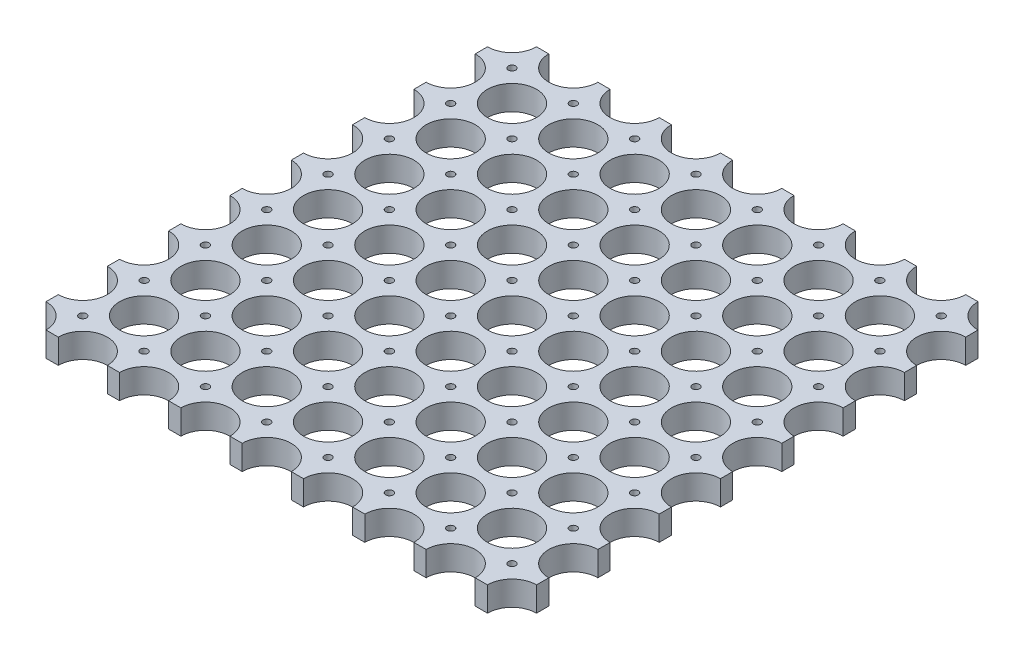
SolidWorks part; units mm, degrees
ref_plane "Front Plane" through (0, 0, 0) normal (0, 0, 1) x (1, 0, 0)
ref_plane "Top Plane" through (0, 0, 0) normal (0, 1, 0) x (1, 0, 0)
ref_plane "Right Plane" through (0, 0, 0) normal (1, 0, 0) x (0, 0, -1)
sketch "Sketch1" plane through (0, 0, 0) normal (0, 1, 0) x (1, 0, 0)
  line L1 (-50, 50) -> (50, 50)
  line L2 (-50, 50) -> (-50, -50)
  line L3 (-50, -50) -> (50, -50)
  line L4 (50, 50) -> (50, -50)
  line L5 (-50, 50) -> (50, -50) construction
  line L6 (-50, -50) -> (50, 50) construction
  point P0 (0, 0)
  dimension "D1" = 100
  dimension "D2" = 100
extrude "Boss-Extrude1" add sketch "Sketch1" along normal blind 5
sketch "Sketch3" plane through (0, 0, 0) normal (0, -1, 0) x (1, 0, 0)
  line L0 (-50, -50) -> (-50, 50) construction
  circle A0 centre (-50, 50) radius 5
  circle A1 centre (-37.5, 50) radius 5
  circle A2 centre (-25, 50) radius 5
  circle A3 centre (-12.5, 50) radius 5
  circle A4 centre (0, 50) radius 5
  circle A5 centre (12.5, 50) radius 5
  circle A6 centre (25, 50) radius 5
  circle A7 centre (37.5, 50) radius 5
  circle A8 centre (50, 50) radius 5
  circle A9 centre (-50, 37.5) radius 5
  circle A10 centre (-37.5, 37.5) radius 5
  circle A11 centre (-25, 37.5) radius 5
  circle A12 centre (-12.5, 37.5) radius 5
  circle A13 centre (0, 37.5) radius 5
  circle A14 centre (12.5, 37.5) radius 5
  circle A15 centre (25, 37.5) radius 5
  circle A16 centre (37.5, 37.5) radius 5
  circle A17 centre (50, 37.5) radius 5
  circle A18 centre (-50, 25) radius 5
  circle A19 centre (-37.5, 25) radius 5
  circle A20 centre (-25, 25) radius 5
  circle A21 centre (-12.5, 25) radius 5
  circle A22 centre (0, 25) radius 5
  circle A23 centre (12.5, 25) radius 5
  circle A24 centre (25, 25) radius 5
  circle A25 centre (37.5, 25) radius 5
  circle A26 centre (50, 25) radius 5
  circle A27 centre (-50, 12.5) radius 5
  circle A28 centre (-37.5, 12.5) radius 5
  circle A29 centre (-25, 12.5) radius 5
  circle A30 centre (-12.5, 12.5) radius 5
  circle A31 centre (0, 12.5) radius 5
  circle A32 centre (12.5, 12.5) radius 5
  circle A33 centre (25, 12.5) radius 5
  circle A34 centre (37.5, 12.5) radius 5
  circle A35 centre (50, 12.5) radius 5
  circle A36 centre (-50, 0) radius 5
  circle A37 centre (-37.5, 0) radius 5
  circle A38 centre (-25, 0) radius 5
  circle A39 centre (-12.5, 0) radius 5
  circle A40 centre (0, 0) radius 5
  circle A41 centre (12.5, 0) radius 5
  circle A42 centre (25, 0) radius 5
  circle A43 centre (37.5, 0) radius 5
  circle A44 centre (50, 0) radius 5
  circle A45 centre (-50, -12.5) radius 5
  circle A46 centre (-37.5, -12.5) radius 5
  circle A47 centre (-25, -12.5) radius 5
  circle A48 centre (-12.5, -12.5) radius 5
  circle A49 centre (0, -12.5) radius 5
  circle A50 centre (12.5, -12.5) radius 5
  circle A51 centre (25, -12.5) radius 5
  circle A52 centre (37.5, -12.5) radius 5
  circle A53 centre (50, -12.5) radius 5
  circle A54 centre (-50, -25) radius 5
  circle A55 centre (-37.5, -25) radius 5
  circle A56 centre (-25, -25) radius 5
  circle A57 centre (-12.5, -25) radius 5
  circle A58 centre (0, -25) radius 5
  circle A59 centre (12.5, -25) radius 5
  circle A60 centre (25, -25) radius 5
  circle A61 centre (37.5, -25) radius 5
  circle A62 centre (50, -25) radius 5
  circle A63 centre (-50, -37.5) radius 5
  circle A64 centre (-37.5, -37.5) radius 5
  circle A65 centre (-25, -37.5) radius 5
  circle A66 centre (-12.5, -37.5) radius 5
  circle A67 centre (0, -37.5) radius 5
  circle A68 centre (12.5, -37.5) radius 5
  circle A69 centre (25, -37.5) radius 5
  circle A70 centre (37.5, -37.5) radius 5
  circle A71 centre (50, -37.5) radius 5
  circle A72 centre (-50, -50) radius 5
  circle A73 centre (-37.5, -50) radius 5
  circle A74 centre (-25, -50) radius 5
  circle A75 centre (-12.5, -50) radius 5
  circle A76 centre (0, -50) radius 5
  circle A77 centre (12.5, -50) radius 5
  circle A78 centre (25, -50) radius 5
  circle A79 centre (37.5, -50) radius 5
  circle A80 centre (50, -50) radius 5
  dimension "D1" = 10
extrude "Cut-Extrude1" cut sketch "Sketch3" against normal blind 5
sketch "Sketch4" plane through (0, 0, 0) normal (0, 1, 0) x (1, 0, 0)
  line L0 (-50, -42.5) -> (-50, -45) construction
  line L1 (-45, -50) -> (-42.5, -50) construction
  circle A0 centre (-43.75, -43.75) radius 0.75
  circle A1 centre (-31.25, -43.75) radius 0.75
  circle A2 centre (-18.75, -43.75) radius 0.75
  circle A3 centre (-6.25, -43.75) radius 0.75
  circle A4 centre (6.25, -43.75) radius 0.75
  circle A5 centre (18.75, -43.75) radius 0.75
  circle A6 centre (31.25, -43.75) radius 0.75
  circle A7 centre (43.75, -43.75) radius 0.75
  circle A8 centre (-43.75, -31.25) radius 0.75
  circle A9 centre (-31.25, -31.25) radius 0.75
  circle A10 centre (-18.75, -31.25) radius 0.75
  circle A11 centre (-6.25, -31.25) radius 0.75
  circle A12 centre (6.25, -31.25) radius 0.75
  circle A13 centre (18.75, -31.25) radius 0.75
  circle A14 centre (31.25, -31.25) radius 0.75
  circle A15 centre (43.75, -31.25) radius 0.75
  circle A16 centre (-43.75, -18.75) radius 0.75
  circle A17 centre (-31.25, -18.75) radius 0.75
  circle A18 centre (-18.75, -18.75) radius 0.75
  circle A19 centre (-6.25, -18.75) radius 0.75
  circle A20 centre (6.25, -18.75) radius 0.75
  circle A21 centre (18.75, -18.75) radius 0.75
  circle A22 centre (31.25, -18.75) radius 0.75
  circle A23 centre (43.75, -18.75) radius 0.75
  circle A24 centre (-43.75, -6.25) radius 0.75
  circle A25 centre (-31.25, -6.25) radius 0.75
  circle A26 centre (-18.75, -6.25) radius 0.75
  circle A27 centre (-6.25, -6.25) radius 0.75
  circle A28 centre (6.25, -6.25) radius 0.75
  circle A29 centre (18.75, -6.25) radius 0.75
  circle A30 centre (31.25, -6.25) radius 0.75
  circle A31 centre (43.75, -6.25) radius 0.75
  circle A32 centre (-43.75, 6.25) radius 0.75
  circle A33 centre (-31.25, 6.25) radius 0.75
  circle A34 centre (-18.75, 6.25) radius 0.75
  circle A35 centre (-6.25, 6.25) radius 0.75
  circle A36 centre (6.25, 6.25) radius 0.75
  circle A37 centre (18.75, 6.25) radius 0.75
  circle A38 centre (31.25, 6.25) radius 0.75
  circle A39 centre (43.75, 6.25) radius 0.75
  circle A40 centre (-43.75, 18.75) radius 0.75
  circle A41 centre (-31.25, 18.75) radius 0.75
  circle A42 centre (-18.75, 18.75) radius 0.75
  circle A43 centre (-6.25, 18.75) radius 0.75
  circle A44 centre (6.25, 18.75) radius 0.75
  circle A45 centre (18.75, 18.75) radius 0.75
  circle A46 centre (31.25, 18.75) radius 0.75
  circle A47 centre (43.75, 18.75) radius 0.75
  circle A48 centre (-43.75, 31.25) radius 0.75
  circle A49 centre (-31.25, 31.25) radius 0.75
  circle A50 centre (-18.75, 31.25) radius 0.75
  circle A51 centre (-6.25, 31.25) radius 0.75
  circle A52 centre (6.25, 31.25) radius 0.75
  circle A53 centre (18.75, 31.25) radius 0.75
  circle A54 centre (31.25, 31.25) radius 0.75
  circle A55 centre (43.75, 31.25) radius 0.75
  circle A56 centre (-43.75, 43.75) radius 0.75
  circle A57 centre (-31.25, 43.75) radius 0.75
  circle A58 centre (-18.75, 43.75) radius 0.75
  circle A59 centre (-6.25, 43.75) radius 0.75
  circle A60 centre (6.25, 43.75) radius 0.75
  circle A61 centre (18.75, 43.75) radius 0.75
  circle A62 centre (31.25, 43.75) radius 0.75
  circle A63 centre (43.75, 43.75) radius 0.75
  dimension "D1" = 1.5
  dimension "D2" = 6.25
  dimension "D3" = 6.25
extrude "Cut-Extrude2" cut sketch "Sketch4" along normal blind 5
